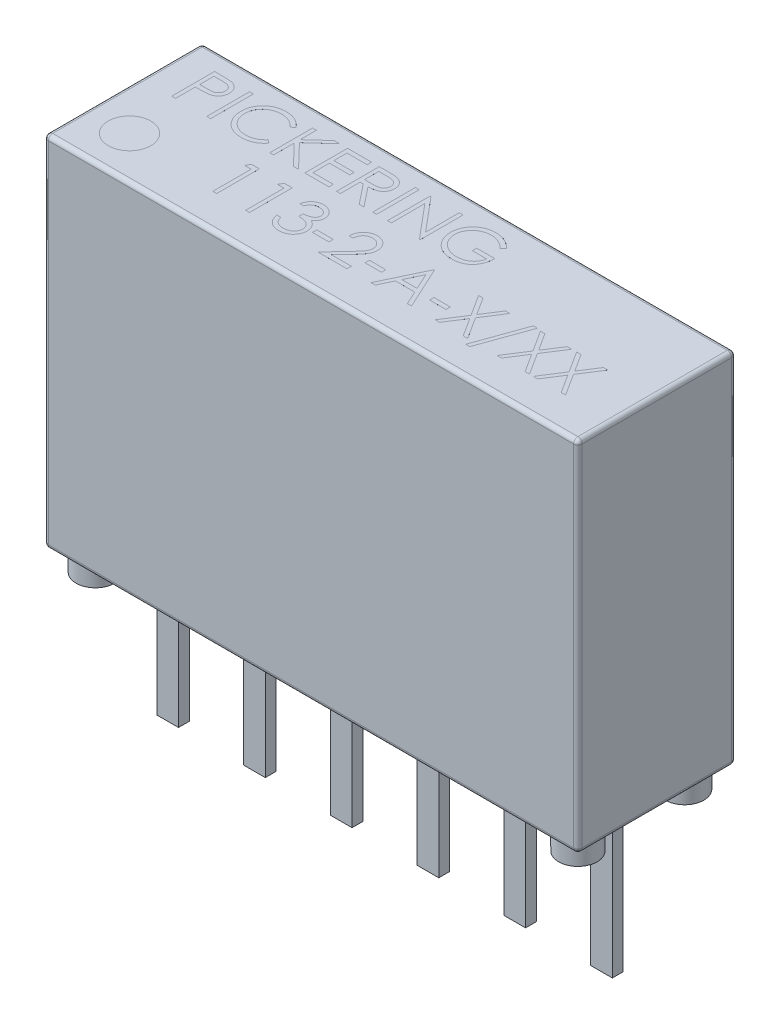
SolidWorks part; units mm, degrees
ref_plane "Front Plane" through (0, 0, 0) normal (0, 0, 1) x (1, 0, 0)
ref_plane "Top Plane" through (0, 0, 0) normal (0, 1, 0) x (1, 0, 0)
ref_plane "Right Plane" through (0, 0, 0) normal (1, 0, 0) x (0, 0, -1)
sketch "Sketch1" plane through (0, 0, 0) normal (0, 1, 0) x (1, 0, 0)
  line L1 (6.25, -1.85) -> (-6.25, -1.85)
  line L2 (6.25, -1.85) -> (6.25, 1.85)
  line L3 (6.25, 1.85) -> (-6.25, 1.85)
  line L4 (-6.25, -1.85) -> (-6.25, 1.85)
  line L5 (6.25, -1.85) -> (-6.25, 1.85) construction
  line L6 (6.25, 1.85) -> (-6.25, -1.85) construction
  point P0 (0, 0)
  dimension "D1" = 12.5
  dimension "D2" = 3.7
extrude "Main Body" add sketch "Sketch1" along normal blind 8.392
sketch "Sketch2" plane through (0, 0, 0) normal (0, -1, 0) x (1, 0, 0)
  line L0 (-6.25, 1.85) -> (6.25, 1.85) construction
  line L1 (-6.25, -1.85) -> (-6.25, 1.85) construction
  line L2 (6.25, -1.85) -> (-6.25, -1.85) construction
  line L3 (6.25, 1.85) -> (6.25, -1.85) construction
  circle A0 centre (-5.65, 1.25) radius 0.45
  circle A1 centre (-5.65, -1.25) radius 0.45
  circle A2 centre (5.65, -1.25) radius 0.45
  circle A3 centre (5.65, 1.25) radius 0.45
  dimension "D1" = 0.9
  dimension "D4" = 0.9
  dimension "D6" = 0.9
  dimension "D8" = 0.9
  dimension "D2" = 0.6
  dimension "D3" = 0.6
  dimension "D5" = 0.6
  dimension "D7" = 0.6
extrude "Feet" add sketch "Sketch2" along normal blind 0.508
sketch "Sketch3" plane through (0, 0, 0) normal (0, -1, 0) x (1, 0, 0)
  line L1 (-2.794, -0.127) -> (-3.302, -0.127)
  line L2 (-2.794, -0.127) -> (-2.794, 0.127)
  line L3 (-2.794, 0.127) -> (-3.302, 0.127)
  line L4 (-3.302, -0.127) -> (-3.302, 0.127)
  line L5 (-2.794, -0.127) -> (-3.302, 0.127) construction
  line L6 (-2.794, 0.127) -> (-3.302, -0.127) construction
  line L7 (-0.762, -0.127) -> (-1.27, -0.127)
  line L8 (-0.762, -0.127) -> (-0.762, 0.127)
  line L9 (-0.762, 0.127) -> (-1.27, 0.127)
  line L10 (-1.27, -0.127) -> (-1.27, 0.127)
  line L11 (-0.762, -0.127) -> (-1.27, 0.127) construction
  line L12 (-0.762, 0.127) -> (-1.27, -0.127) construction
  line L13 (1.27, -0.127) -> (0.762, -0.127)
  line L14 (1.27, -0.127) -> (1.27, 0.127)
  line L15 (1.27, 0.127) -> (0.762, 0.127)
  line L16 (0.762, -0.127) -> (0.762, 0.127)
  line L17 (1.27, -0.127) -> (0.762, 0.127) construction
  line L18 (1.27, 0.127) -> (0.762, -0.127) construction
  line L19 (2.794, -0.127) -> (3.302, -0.127)
  line L20 (2.794, -0.127) -> (2.794, 0.127)
  line L21 (2.794, 0.127) -> (3.302, 0.127)
  line L22 (3.302, -0.127) -> (3.302, 0.127)
  line L23 (2.794, -0.127) -> (3.302, 0.127) construction
  line L24 (2.794, 0.127) -> (3.302, -0.127) construction
  line L26 (-6.25, -1.85) -> (-6.25, 1.85) construction
  line L27 (-5.334, -0.127) -> (-4.826, -0.127)
  line L28 (-5.334, -0.127) -> (-5.334, 0.127)
  line L29 (-5.334, 0.127) -> (-4.826, 0.127)
  line L30 (-4.826, -0.127) -> (-4.826, 0.127)
  line L31 (-5.334, -0.127) -> (-4.826, 0.127) construction
  line L32 (-5.334, 0.127) -> (-4.826, -0.127) construction
  line L33 (4.826, -0.127) -> (5.334, -0.127)
  line L34 (4.826, -0.127) -> (4.826, 0.127)
  line L35 (4.826, 0.127) -> (5.334, 0.127)
  line L36 (5.334, -0.127) -> (5.334, 0.127)
  line L37 (4.826, -0.127) -> (5.334, 0.127) construction
  line L38 (4.826, 0.127) -> (5.334, -0.127) construction
  point P0 (-3.048, 0)
  point P5 (-1.016, 0)
  point P10 (1.016, 0)
  point P15 (3.048, 0)
  point P23 (-5.08, 0)
  point P28 (5.08, 0)
  dimension "D1" = 0.508
  dimension "D2" = 0.254
  dimension "D3" = 0.508
  dimension "D4" = 0.254
  dimension "D5" = 0.508
  dimension "D6" = 0.254
  dimension "D7" = 0.508
  dimension "D8" = 0.254
  dimension "D9" = 0.508
  dimension "D10" = 0.508
  dimension "D11" = 2.032
  dimension "D12" = 2.032
  dimension "D13" = 2.032
  dimension "D14" = 2.032
  dimension "D15" = 2.032
  dimension "D16" = 1.17
extrude "Pins" add sketch "Sketch3" along normal blind 3.808
sketch "Sketch4"
  dimension "D3" = 1
  dimension "D1" = 1.45
  dimension "D2" = 1.45
  dimension "D4" = 1
  dimension "D5" = 1
extrude "Lettering" add sketch "Sketch4" along normal blind 0.0001
fillet "Fillet1" radius 0.1 12 edges at (6.25, 8.392, 0) (6.25, 0, 0) (6.25, 4.196, -1.85) (0, 8.392, -1.85) (0, 0, -1.85) (-6.25, 4.196, -1.85) (-6.25, 8.392, 0) (-6.25, 0, 0) (-6.25, 4.196, 1.85) (0, 8.392, 1.85) (6.25, 4.196, 1.85) (0, 0, 1.85)
